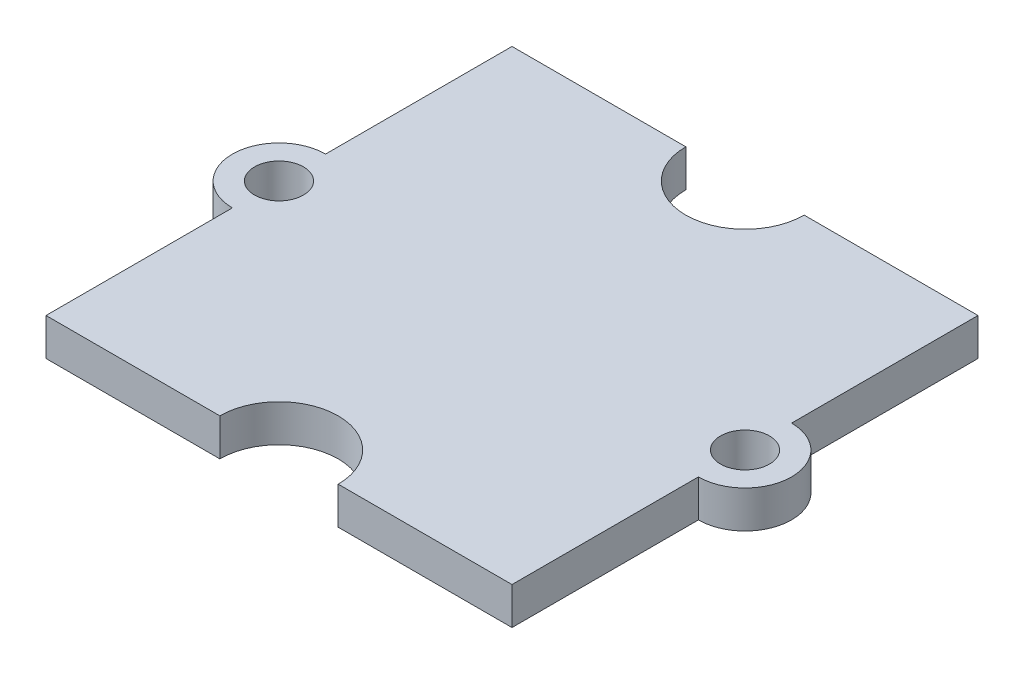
SolidWorks part; units mm, degrees
ref_plane "Plan de face" through (0, 0, 0) normal (0, 0, 1) x (1, 0, 0)
ref_plane "Plan de dessus" through (0, 0, 0) normal (0, 1, 0) x (1, 0, 0)
ref_plane "Plan de droite" through (0, 0, 0) normal (1, 0, 0) x (0, 0, -1)
sketch "Esquisse1" plane through (0, 0, 0) normal (0, 1, 0) x (1, 0, 0)
  line L0 (0, -6.686) -> (0, 19.0735) construction
  line L1 (-6.5549, 0) -> (20.5339, 0) construction
  line L2 (10, -13.0303) -> (10, 26.0418) construction
  line L3 (-10, -13.0303) -> (-10, 26.0418) construction
  line L4 (30.6769, 10) -> (-12.9387, 10) construction
  line L5 (30.6769, -10) -> (-12.9387, -10) construction
  line L6 (10, -2) -> (10, -10)
  line L7 (-10, 10) -> (-2.54, 10)
  line L8 (-10, 10) -> (-10, 2)
  line L9 (-10, -10) -> (-2.54, -10)
  line L10 (10, 10) -> (10, 2)
  line L11 (-10, -2) -> (-10, -10)
  line L12 (2.54, 10) -> (10, 10)
  line L13 (2.54, -10) -> (10, -10)
  circle A0 centre (10, 0) radius 1.05
  arc A1 (10, -2) -> (10, 2) centre (10, 0) ccw
  circle A2 centre (-10, 0) radius 1.05
  arc A3 (-10, -2) -> (-10, 2) centre (-10, 0) cw
  arc A4 (-2.54, 10) -> (2.54, 10) centre (0, 10) ccw
  arc A5 (-2.54, -10) -> (2.54, -10) centre (0, -10) cw
  dimension "D1" = 10
  dimension "D2" = 10
extrude "Boss.-Extru.1" add sketch "Esquisse1" along normal blind 1.6
